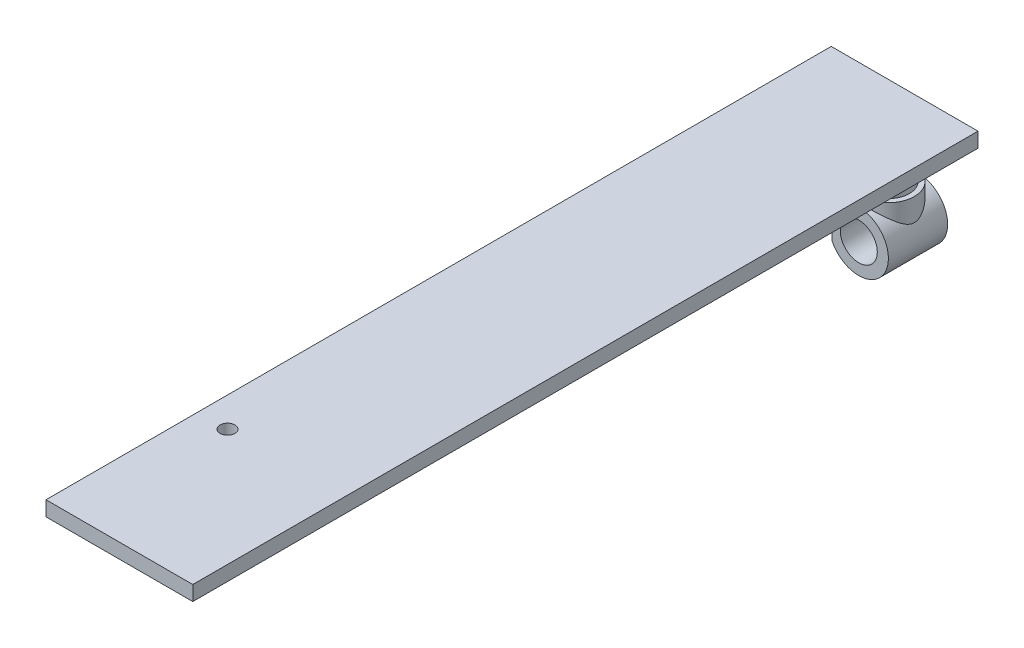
SolidWorks part; units mm, degrees
ref_plane "Plane1" through (0, 0, 0) normal (0, 0, 1) x (1, 0, 0)
ref_plane "Plane2" through (0, 0, 0) normal (0, 1, 0) x (1, 0, 0)
ref_plane "Plane3" through (0, 0, 0) normal (1, 0, 0) x (0, 0, -1)
sketch "Esquisse1" plane through (0, 0, 0) normal (0, 0, 1) x (1, 0, 0)
  circle A0 centre (0, 0) radius 20
  circle A1 centre (0, 0) radius 12.5
  dimension "D1" = 25
  dimension "D2" = 40
extrude "Base-Extrusion" add sketch "Esquisse1" along normal mid plane 40
ref_plane "Plan5" through (0, 55, 0) normal (0, 1, 0) x (-1, 0, 0)
sketch "Esquisse3" plane through (0, 55, 0) normal (0, 1, 0) x (-1, 0, 0)
  circle A0 centre (0, 0) radius 14.1421
extrude "Boss.-Extru.2" add sketch "Esquisse3" along normal up to surface (35 mm away)
ref_plane "Plan7" through (0, 25, 0) normal (0, 1, 0) x (-1, 0, 0)
sketch "Esquisse4" plane through (0, 25, 0) normal (0, 1, 0) x (-1, 0, 0)
  circle A0 centre (0, 0) radius 17.5
  dimension "D1" = 35
extrude "Boss.-Extru.3" add sketch "Esquisse4" along normal up to surface (5 mm away)
chamfer "Chanfrein2" distance 1 angle 45 1 edges at (0, 55, 14.1421)
sketch "Esquisse5" plane through (0, 0, 20) normal (0, 0, 1) x (1, 0, 0)
  line L0 (0, 20.1601) -> (0, -20) construction
  line L1 (-28, 10) -> (-18, 10)
  line L2 (-28, 10) -> (-28, -20)
  line L3 (-28, -20) -> (-18, -20)
  line L4 (-18, 10) -> (-18, -20)
  line L5 (0, 19.9999) -> (0, 25) construction
  dimension "D1" = 18
extrude "Enlèv. mat.-Extru.1" cut sketch "Esquisse5" against normal through all
sketch "Esquisse6" plane through (0, 55, 0) normal (0, 1, 0) x (-1, 0, 0)
  line L1 (-30.7914, -29.6868) -> (68.2785, -29.6868)
  line L2 (-30.7914, -29.6868) -> (-30.7914, 370.3132)
  line L3 (-30.7914, 370.3132) -> (68.2785, 370.3132)
  line L4 (68.2785, -29.6868) -> (68.2785, 370.3132)
  dimension "D1" = 400
extrude "Extrusion1" add sketch "Esquisse6" against normal blind 10
sketch "Esquisse14" plane through (0, 0, 370.3132) normal (0, 0, 1) x (1, 0, 0)
  line L1 (-68.2785, 55) -> (30.7914, 55)
  line L2 (-68.2785, 55) -> (-68.2785, 45)
  line L3 (-68.2785, 45) -> (30.7914, 45)
  line L4 (30.7914, 55) -> (30.7914, 45)
extrude "Boss.-Extru.4" add sketch "Esquisse14" along normal blind 130
sketch "Esquisse15" plane through (0, 45, 0) normal (0, -1, 0) x (1, 0, 0)
  line L0 (-68.2785, -29.6868) -> (-68.2785, 500.3132) construction
  line L1 (-28.2785, 392.8064) -> (-68.2785, 392.8064)
  line L2 (-28.2785, 392.8064) -> (-28.2785, 402.8064)
  line L3 (-28.2785, 402.8064) -> (-68.2785, 402.8064)
  line L4 (-68.2785, 392.8064) -> (-68.2785, 402.8064)
  dimension "D1" = 10
  dimension "D2" = 40
sketch "Esquisse19" plane through (0, 45, 0) normal (0, -1, 0) x (1, 0, 0)
  line L0 (-74.7897, 397.8064) -> (-17.5036, 397.8064) construction
  line L1 (-48.2785, 414.5258) -> (-48.2785, 379.2356) construction
  line L2 (-68.2785, -29.6868) -> (-68.2785, 500.3132) construction
  line L3 (-68.2785, 500.3132) -> (30.7914, 500.3132) construction
  circle A0 centre (-48.2785, 397.8064) radius 5
  dimension "D2" = 10
  dimension "D1" = 20
  dimension "D3" = 102.5068
extrude "Enlèv. mat.-Extru.6" cut sketch "Esquisse19" against normal blind 10
